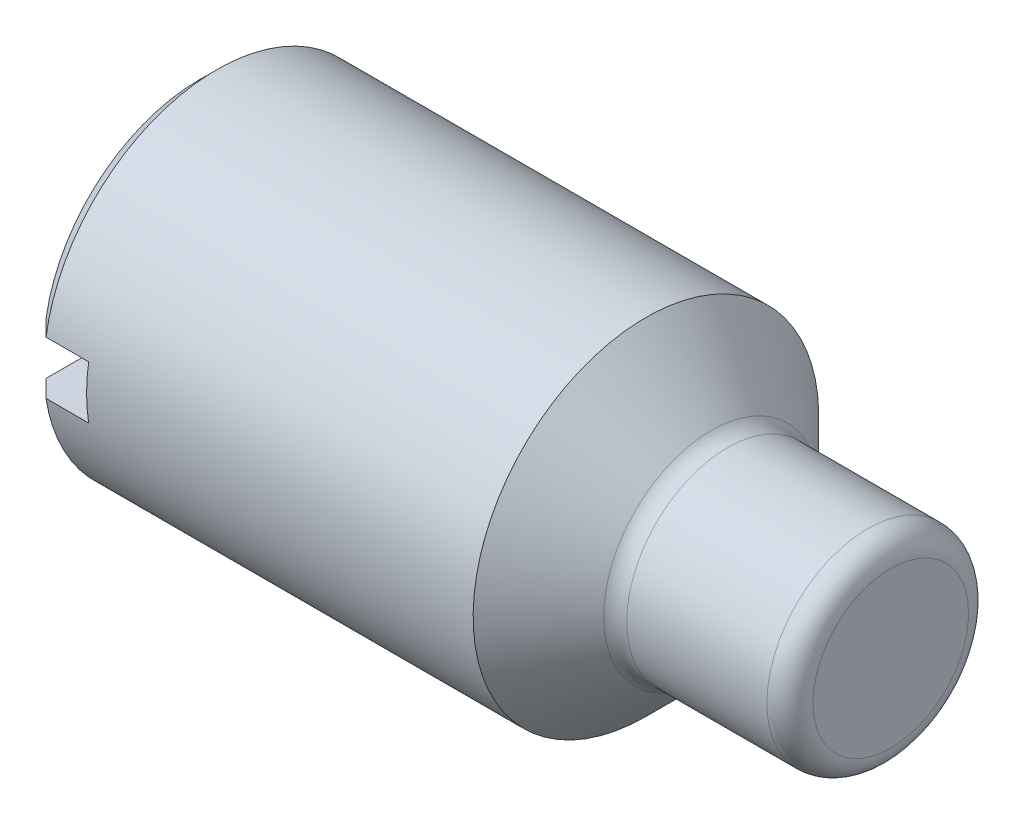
SolidWorks part; units mm, degrees
ref_plane "Front" through (0, 0, 0) normal (0, 0, 1) x (1, 0, 0)
ref_plane "Top" through (0, 0, 0) normal (0, 1, 0) x (1, 0, 0)
ref_plane "Right" through (0, 0, 0) normal (1, 0, 0) x (0, 0, -1)
sketch "Sketch1" plane through (0, 0, 0) normal (0, 0, 1) x (1, 0, 0)
  line L0 (6, 0) -> (0, 0)
  line L1 (6, 0) -> (6, 0.875)
  line L2 (6, 0.875) -> (4.5, 0.875)
  line L3 (4.5, 0.875) -> (3.875, 1.5)
  line L4 (3.875, 1.5) -> (0, 1.5)
  line L5 (-8.5703, 0) -> (3.0325, 0) construction
  line L7 (0, 1.5) -> (0, 0)
  dimension "D1" = 45
  dimension "l" = 6
  dimension "d" = 3
  dimension "z" = 1.5
  dimension "dp" = 1.75
revolve "Base" add sketch "Sketch1" angle 360 about L5
sketch "Sketch2" plane through (0, 0, 0) normal (0, 0, 1) x (1, 0, 0)
  line L0 (0, 1.5) -> (0, -1.5) construction
  line L1 (0, 0.23) -> (0.52, 0.23)
  line L2 (0, 0.23) -> (0, -0.23)
  line L3 (0, -0.23) -> (0.52, -0.23)
  line L4 (0.52, 0.23) -> (0.52, -0.23)
  dimension "m" = 0.23
  dimension "n" = 0.46
  dimension "t" = 0.52
extrude "Notch" cut sketch "Sketch2" against normal through all and the other way through all
fillet "Fillet1" radius 0.2 2 edges at (6, -0.875, 0) (4.5, -0.875, 0)
chamfer "Chamfer1" distance 0.15 angle 45 2 edges at (0, 1.5, 0) (0, -1.5, 0)
sketch "Sketch3" plane through (0, 0, 0) normal (0, 0, 1) x (1, 0, 0)
  line L0 (0.15, 1.3701) -> (0.225, 1.5)
  line L1 (0.225, 1.5) -> (0.225, 1.65)
  line L2 (0.225, 1.65) -> (0.075, 1.65)
  line L3 (0.075, 1.65) -> (0.075, 1.5)
  line L4 (0.075, 1.5) -> (0.15, 1.3701)
  line L5 (0, 0) -> (1.285, 0) construction
  line L7 (0, 1.35) -> (0, 0.23) construction
  dimension "D1" = 3
  dimension "D2" = 0.15
  dimension "D3" = 0.15
revolve "Cut-Revolve10" [suppressed] cut sketch "Sketch3" angle 360 about L5
pattern_linear "LPattern10" [suppressed] count 24 spacing 0.18 along (1, 0, 0)
equation "\"D1@Chamfer1\" = (  \"d@Sketch1\" - \"D1@ThreadCosmetic1\" )  / 2"
equation "\"m@Sketch2\" = \"n@Sketch2\" / 2"
equation "\"D3@Sketch3\" = \"D1@Chamfer1\""
equation "\"D1@Sketch3\" = \"d@Sketch1\""
equation "\"D2@Sketch3\" =  ( \"d@Sketch1\" - \"D1@ThreadCosmetic1\" )  / 2"
equation "\"D3@LPattern10\" = \"D2@Sketch3\" * 1.2"
equation "\"D1@LPattern10\" =  ( \"l@Sketch1\" - \"z@Sketch1\" - \"D1@Chamfer1\" )  / \"D3@LPattern10\""
